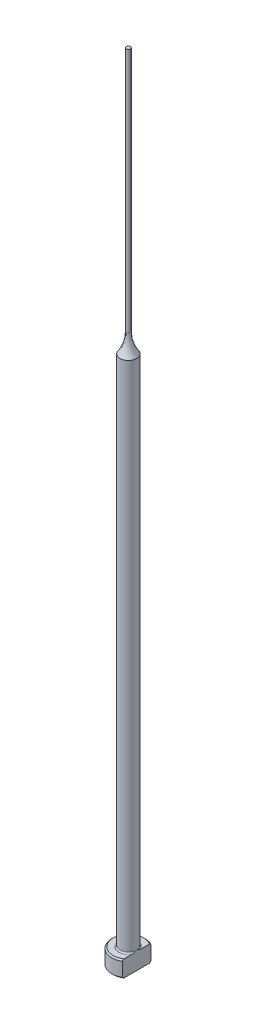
SolidWorks part; units mm, degrees
ref_plane "Front Plane" through (0, 0, 0) normal (0, 0, 1) x (1, 0, 0)
ref_plane "Top Plane" through (0, 0, 0) normal (0, 1, 0) x (1, 0, 0)
ref_plane "Right Plane" through (0, 0, 0) normal (1, 0, 0) x (0, 0, -1)
sketch "Sketch1" plane through (0, 0, 0) normal (0, 0, 1) x (1, 0, 0)
  line L0 (0, 259.9588) -> (0, -15.1925) construction
  line L1 (0, 0) -> (-3.175, 0)
  line L2 (-3.175, 0) -> (-3.175, 3.175)
  line L3 (-3.175, 3.175) -> (-1.5875, 3.175)
  line L4 (-0.3962, 105.3027) -> (-0.3962, 152.4)
  line L5 (-0.3962, 152.4) -> (0, 152.4)
  line L6 (0, 152.4) -> (0, 0)
  line L7 (-1.5875, 3.175) -> (-1.5875, 101.6)
  arc A0 (-1.5875, 101.6) -> (-0.3962, 105.3027) centre (-6.7462, 105.3027) ccw
  point P13 (-1.5875, 0)
  dimension "D1" = 6.35
  dimension "L" = 152.4
  dimension "D2" = 3.175
  dimension "H" = 6.35
  dimension "T" = 3.175
  dimension "D" = 0.7925
  dimension "S" = 101.6
revolve "Revolve1" add sketch "Sketch1" angle 360 about L0
chamfer "Chamfer1" distance 0.254 angle 45 2 edges at (0, 3.175, 3.175) (0, 0, 3.175)
fillet "Fillet1" radius 0.254 1 edges at (0, 3.175, 1.5875)
sketch "Sketch2" plane through (0, 0, 0) normal (0, 1, 0) x (1, 0, 0)
  line L0 (1.5875, -2.7496) -> (1.5875, 2.7496)
  circle A0 centre (0, 0) radius 3.175 construction
  arc A2 (1.5875, -2.7496) -> (1.5875, 2.7496) centre (0, 0) ccw
  circle A3 centre (0, 0) radius 3.175 construction
  circle A4 centre (0, 0) radius 1.5875 construction
extrude "Key Head" cut sketch "Sketch2" along normal up to next
